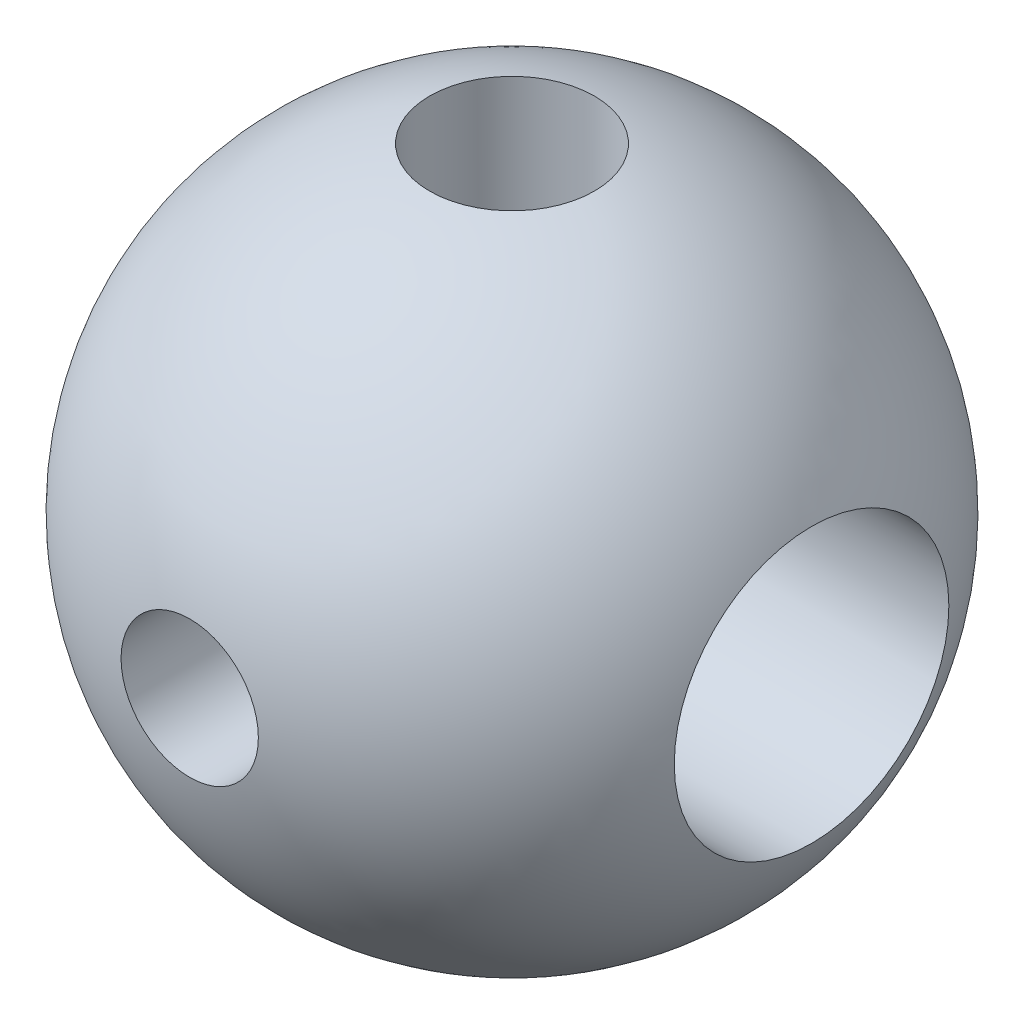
SolidWorks part; units mm, degrees
ref_plane "Plan de face" through (0, 0, 0) normal (0, 0, 1) x (1, 0, 0)
ref_plane "Plan de dessus" through (0, 0, 0) normal (0, 1, 0) x (1, 0, 0)
ref_plane "Plan de droite" through (0, 0, 0) normal (1, 0, 0) x (0, 0, -1)
sketch "Esquisse1" plane through (0, 0, 0) normal (0, 0, 1) x (1, 0, 0)
  line L0 (0, 48) -> (0, -48)
  arc A0 (0, 48) -> (0, -48) centre (0, 0) ccw
  dimension "D1" = 96
revolve "Révolution1" add sketch "Esquisse1" angle 360 about L0
sketch "Esquisse2" plane through (0, 0, 0) normal (0, 1, 0) x (1, 0, 0)
  circle A0 centre (0, 0) radius 12
  dimension "D1" = 24
extrude "Enlèv. mat.-Extru.1" cut sketch "Esquisse2" against normal through all and the other way through all
sketch "Esquisse3" plane through (0, 0, 0) normal (1, 0, 0) x (0, 0, -1)
  circle A0 centre (0, 0) radius 20
  dimension "D1" = 40
extrude "Enlèv. mat.-Extru.2" cut sketch "Esquisse3" against normal through all and the other way through all
sketch "Esquisse4" plane through (0, 0, 0) normal (0, 0, 1) x (1, 0, 0)
  circle A0 centre (0, 0) radius 10
  dimension "D1" = 20
extrude "Enlèv. mat.-Extru.3" cut sketch "Esquisse4" against normal through all and the other way through all
